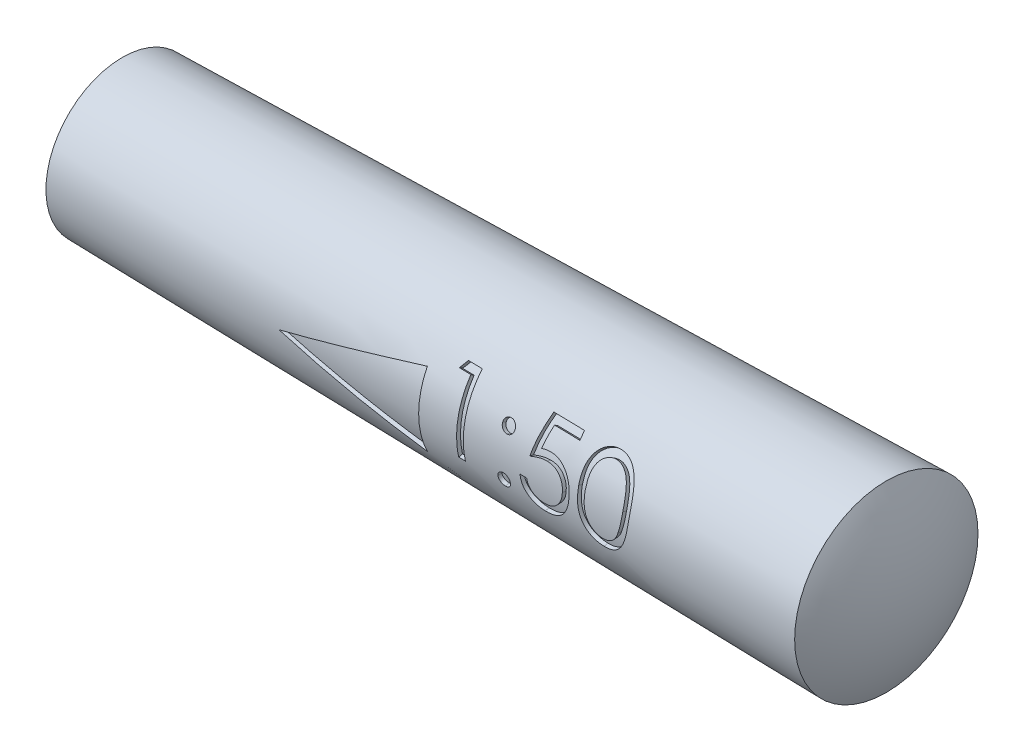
SolidWorks part; units mm, degrees
ref_plane "Front Plane" through (0, 0, 0) normal (0, 0, 1) x (1, 0, 0)
ref_plane "Top Plane" through (0, 0, 0) normal (0, 1, 0) x (1, 0, 0)
ref_plane "Right Plane" through (0, 0, 0) normal (1, 0, 0) x (0, 0, -1)
sketch "Sketch1" plane through (0, 0, 0) normal (1, 0, 0) x (0, 0, -1)
  circle A0 centre (0, 0) radius 1
  dimension "D1" = 2
extrude "Extrude1" add sketch "Sketch1" along normal mid plane 10
draft "Draft1" type of draft neutral plane draft angle 1.146 faces to draft 1 parameters "D1"=1.146
sketch "Sketch2" plane through (0, 0, 0) normal (0, 0, 1) x (1, 0, 0)
  line L0 (-5, 0) -> (-5, 1)
  line L1 (-5, 1) -> (-5, -1) construction
  line L2 (-5, 0) -> (-5.3, 0)
  line L3 (-5.3, 0) -> (-5.3, -1.1) construction
  line L4 (5, 0) -> (5, 1.2)
  line L5 (5, -1.2) -> (5, 1.2) construction
  line L6 (5, 0) -> (5.3, 0)
  line L7 (5.3, 0) -> (5.3, -1.1) construction
  line L8 (-5, -1) -> (5, -1.2) construction
  arc A0 (-5.3, 0) -> (-5, 1) centre (-3.4833, 0) cw
  arc A1 (5.3, 0) -> (5, 1.2) centre (2.75, 0) ccw
  point P14 (0, -1.1)
revolve "Revolve1" add sketch "Sketch2" angle 360 about L2
sketch "Sketch5" plane through (0, 0, 0) normal (0, 0, 1) x (1, 0, 0)
  line L0 (0, 1.1) -> (0, -1.1) construction
  line L1 (5, 1.2) -> (-5, 1) construction
  line L2 (-5, -1) -> (5, -1.2) construction
ref_plane "Plane2" through (0, 0, 0) normal (-0.02, 0, 0.9998) x (0.9998, 0, 0.02)
sketch "Sketch6" plane through (0, 0, 0) normal (-0.02, 0, 0.9998) x (0.9998, 0, 0.02)
  line L0 (0, 0) -> (0, 0.5)
  line L1 (0, 1.1) -> (0, -1.1) construction
  line L2 (0, 0.5) -> (-1.866, 0)
  line L3 (-1.866, 0) -> (0, -0.5)
  line L4 (0, -0.5) -> (0, 0)
  line L5 (0, -0.25) -> (3, -0.25) construction
  text T0 "1:50" font "Century Gothic" height 1
  dimension "D1" = 1
  dimension "D2" = 30
  dimension "D3" = 3
wrap "Wrap2" sketch "Sketch6" wrap type deboss source sketch "Sketch6" thickness 0.05 parameters "D1"=0.05
equation "\"D2@Sketch2\" = \"D1@Sketch2\""
